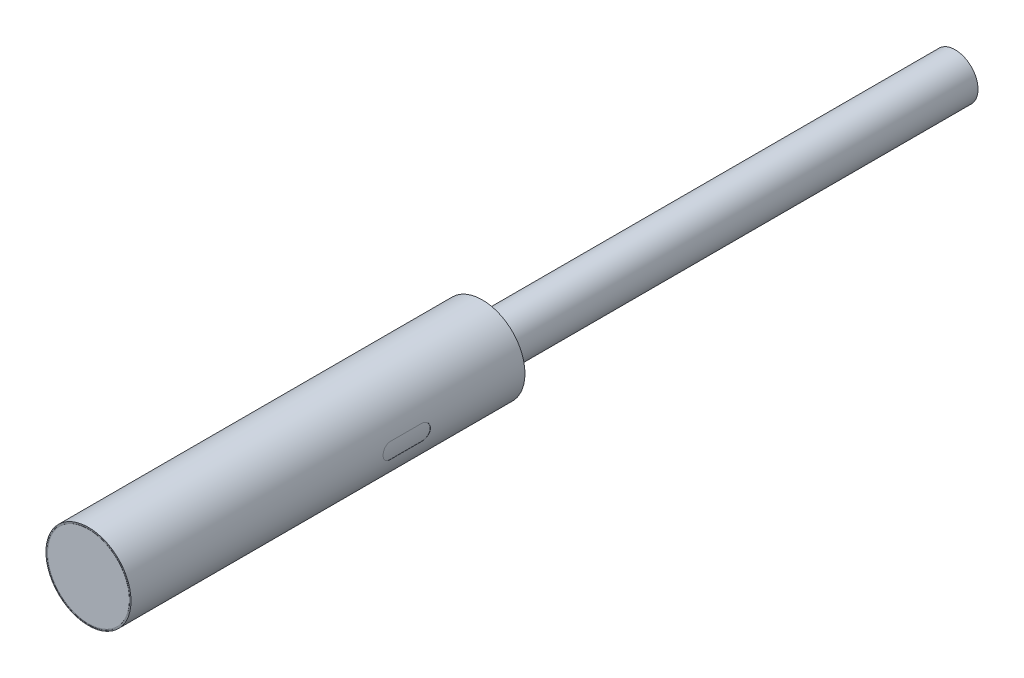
SolidWorks part; units mm, degrees
ref_plane "前视基准面" through (0, 0, 0) normal (0, 0, 1) x (1, 0, 0)
ref_plane "上视基准面" through (0, 0, 0) normal (0, 1, 0) x (1, 0, 0)
ref_plane "右视基准面" through (0, 0, 0) normal (1, 0, 0) x (0, 0, -1)
sketch "草图2" plane through (0, 0, 0) normal (0, 0, 1) x (1, 0, 0)
  circle A0 centre (0, 0) radius 2.7
  dimension "D1" = 5.4
extrude "凸台-拉伸1" add sketch "草图2" against normal blind 25
sketch "草图3" plane through (0, 0, 0) normal (0, 0, 1) x (1, 0, 0)
  circle A0 centre (0, 0) radius 2.6
  circle A1 centre (0, 0) radius 2.65
  dimension "D1" = 5.3
  dimension "D2" = 5.2
extrude "切除-拉伸1" cut sketch "草图3" against normal blind 0.01
sketch "草图4" plane through (0, 0, -25) normal (0, 0, -1) x (-1, 0, 0)
  circle A0 centre (0, 0) radius 1.45
  dimension "D1" = 2.9
extrude "凸台-拉伸2" add sketch "草图4" along normal blind 30
ref_plane "基准面1" through (5, 0, 0) normal (1, 0, 0) x (0, 0, -1)
sketch "草图5" plane through (5, 0, 0) normal (1, 0, 0) x (0, 0, -1)
  line L0 (16.5, 0) -> (18.5, 0) construction
  line L1 (16.5, 0.5) -> (18.5, 0.5)
  line L2 (16.5, -0.5) -> (18.5, -0.5)
  line L3 (0, 2.7) -> (0, -2.7) construction
  arc A0 (16.5, 0.5) -> (16.5, -0.5) centre (16.5, 0) ccw
  arc A1 (18.5, -0.5) -> (18.5, 0.5) centre (18.5, 0) ccw
  point P2 (17.5, 0)
  dimension "D2" = 3
  dimension "D1" = 1
  dimension "D3" = 17.5
wrap "包覆1" sketch "草图5" wrap type deboss source sketch "草图5" thickness 0.01 parameters "D1"=0.01
